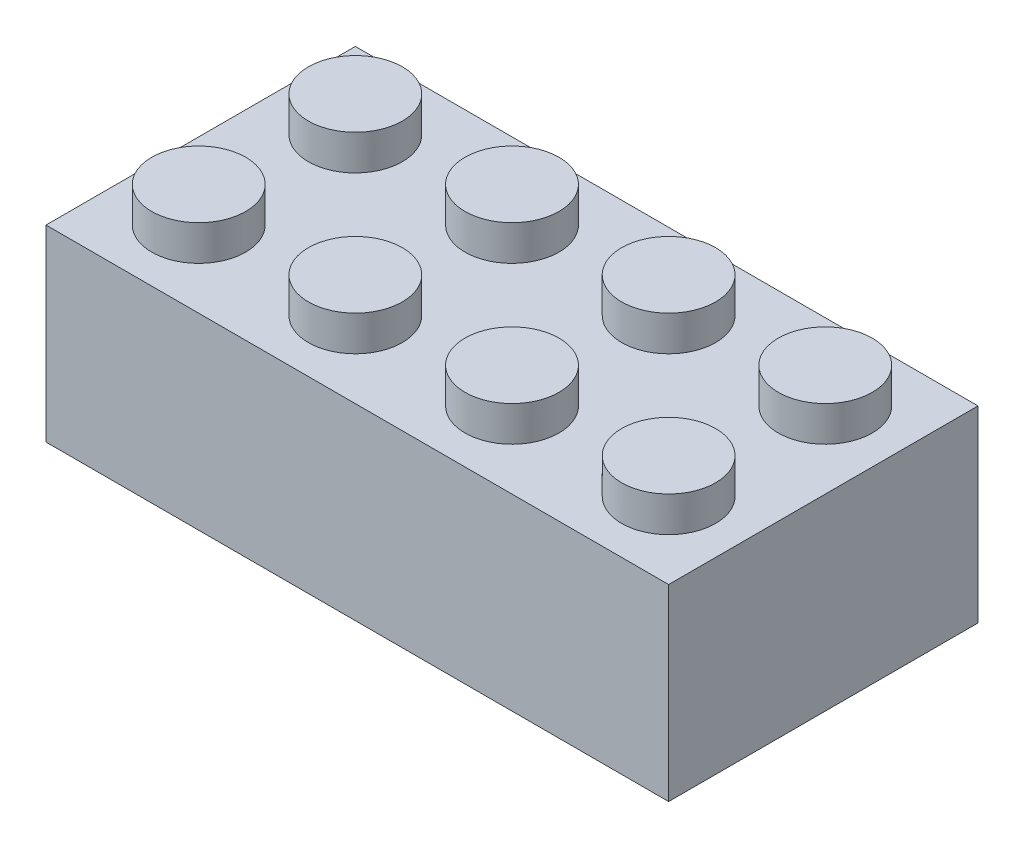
SolidWorks part; units mm, degrees
ref_plane "Ebene vorne" through (0, 0, 0) normal (0, 0, 1) x (1, 0, 0)
ref_plane "Ebene oben" through (0, 0, 0) normal (0, 1, 0) x (1, 0, 0)
ref_plane "Ebene rechts" through (0, 0, 0) normal (1, 0, 0) x (0, 0, -1)
sketch "Skizze1" plane through (0, 0, 0) normal (0, 0, 1) x (1, 0, 0)
  line L5 (0, 0) -> (31.8, 0)
  line L6 (0, 0) -> (0, 9.6)
  line L7 (0, 9.6) -> (31.8, 9.6)
  line L8 (31.8, 0) -> (31.8, 9.6)
  dimension "D1" = 31.8
  dimension "D2" = 9.6
extrude "Aufsatz-Linear austragen1" add sketch "Skizze1" along normal blind 15.8
sketch "Skizze2" plane through (0, 9.6, 0) normal (0, 1, 0) x (1, 0, 0)
  line L0 (0, -15.8) -> (0, 0) construction
  line L1 (0, -7.9) -> (31.8, -7.9) construction
  line L2 (31.8, -15.8) -> (31.8, 0) construction
  line L3 (15.9, 0) -> (15.9, -15.8) construction
  line L4 (31.8, 0) -> (0, 0) construction
  line L5 (31.8, -15.8) -> (0, -15.8) construction
  circle A0 centre (3.9, -3.9) radius 2.4
  circle A1 centre (11.9, -3.9) radius 2.4
  circle A2 centre (11.9, -11.9) radius 2.4
  circle A3 centre (3.9, -11.9) radius 2.4
  circle A4 centre (19.9, -11.9) radius 2.4
  circle A5 centre (27.9, -11.9) radius 2.4
  circle A6 centre (19.9, -3.9) radius 2.4
  circle A7 centre (27.9, -3.9) radius 2.4
  dimension "D1" = 4.8
  dimension "D2" = 8
  dimension "D3" = 3.9
  dimension "D4" = 8
extrude "Aufsatz-Linear austragen2" add sketch "Skizze2" along normal blind 1.8
